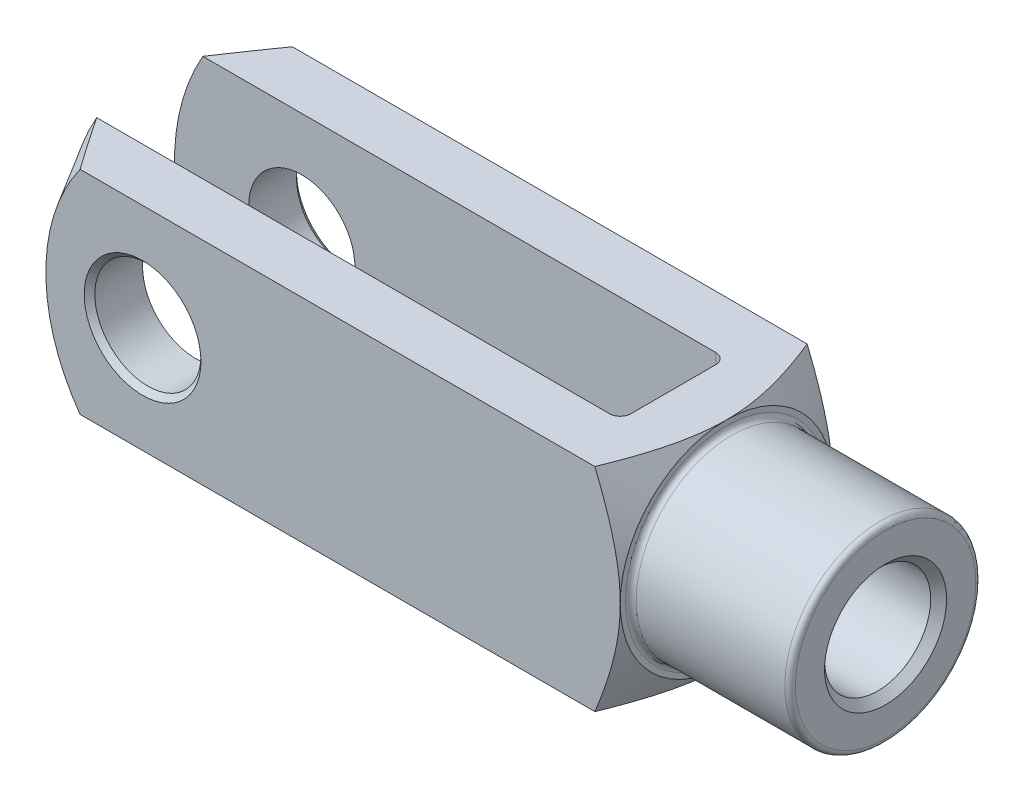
SolidWorks part; units mm, degrees
ref_plane "Front Plane" through (0, 0, 0) normal (0, 0, 1) x (1, 0, 0)
ref_plane "Top Plane" through (0, 0, 0) normal (0, 1, 0) x (1, 0, 0)
ref_plane "Right Plane" through (0, 0, 0) normal (1, 0, 0) x (0, 0, -1)
sketch "Sketch1" plane through (0, 0, 0) normal (1, 0, 0) x (0, 0, -1)
  line L0 (0, 0) -> (0, 50000) construction
  line L1 (0, 0) -> (50000, 0) construction
  line L2 (-10, -10) -> (-10, 10)
  line L3 (-10, 10) -> (10, 10)
  line L4 (10, -10) -> (10, 10)
  line L5 (-10, -10) -> (10, -10)
  point P9 (0, 10)
  point P11 (10, 0)
  point P12 (-10, 0)
  dimension "D1" = 20
  dimension "D2" = 20
extrude "Extrude1" add sketch "Sketch1" against normal blind 72
sketch "Sketch2" plane through (0, 0, 0) normal (1, 0, 0) x (0, 0, -1)
  circle A0 centre (0, 0) radius 9
  circle A1 centre (0, 0) radius 18
  dimension "D1" = 18
  dimension "D2" = 36
extrude "Extrude2" cut sketch "Sketch2" against normal blind 15
sketch "Sketch3" plane through (0, 0, 10) normal (0, 0, 1) x (1, 0, 0)
  circle A0 centre (-60, 0) radius 5
  dimension "D1" = 10
  dimension "D2" = 60
extrude "Extrude3" cut sketch "Sketch3" against normal through all
sketch "Sketch4" plane through (0, 10, 0) normal (0, 1, 0) x (1, 0, 0)
  line L0 (0, 0) -> (-50000, 0) construction
  line L1 (-72, -5) -> (-72, 5)
  line L2 (-72, 10) -> (-72, -10) construction
  line L3 (-72, 5) -> (-20, 5)
  line L4 (-20, 5) -> (-20, -5)
  line L5 (-60, 10) -> (-60, -10) construction
  line L6 (-72, -5) -> (-20, -5)
  point P7 (-60, 0)
  point P13 (-20, 0)
  point P14 (-72, 0)
  dimension "D1" = 40
  dimension "D2" = 10
extrude "Extrude4" cut sketch "Sketch4" against normal through all
fillet "Fillet1" radius 1 2 edges at (-20, 0, 5) (-20, 0, -5)
fillet "Fillet2" radius 0.5 2 edges at (0, 0, -9) (-15, 0, -9)
chamfer "Chamfer2" distance 0.5 angle 45 2 edges at (-55, 0, -10) (-55, 0, 10)
sketch "Sketch6" plane through (0, 0, 0) normal (0, 0, 1) x (1, 0, 0)
  line L0 (-15, -10) -> (-15, -20)
  line L1 (-15, -20) -> (-20.7735, -20)
  line L2 (-20.7735, -20) -> (-15, -10)
  dimension "D1" = 30
  dimension "D2" = 20
revolve "Cut-Revolve1" cut sketch "Sketch6" angle 360 about axis through (-15, 0, 0) along (1, 0, 0)
sketch "Sketch7" plane through (0, 0, 0) normal (0, 1, 0) x (1, 0, 0)
  line L0 (-69.1132, -10) -> (-72, -5)
  line L1 (-72, 5) -> (-69.1132, 10)
  line L2 (-69.1132, 10) -> (-92, 10)
  line L3 (-72, 5) -> (-72, -5)
  line L4 (-92, 10) -> (-92, -10)
  line L5 (-92, -10) -> (-69.1132, -10)
  line L6 (-72, 10) -> (-17.3915, 10) construction
  line L7 (-72, -10) -> (-17.3915, -10) construction
  line L8 (-52, 0.6162) -> (-52, 50000.6162) construction
  dimension "D1" = 120
  dimension "D2" = 20
  dimension "D3" = 20
revolve "Cut-Revolve2" cut sketch "Sketch7" angle 180 about L8
sketch "Sketch8" plane through (0, 0, 0) normal (1, 0, 0) x (0, 0, -1)
  circle A0 centre (0, 0) radius 5
  dimension "D1" = 10
extrude "Extrude5" cut sketch "Sketch8" against normal through all
chamfer "Chamfer3" distance 0.75 angle 45 1 edges at (0, 0, -5)
equation "\"D2@Sketch1\" = \"D1@Sketch1\""
equation "\"D2@Sketch2\" = \"D1@Sketch2\"*2"
equation "\"D2@Sketch6\" = \"D1@Sketch1\""
equation "\"D2@Sketch7\" = \"D1@Sketch1\""
equation "\"D3@Sketch7\" = \"D1@Sketch1\""
